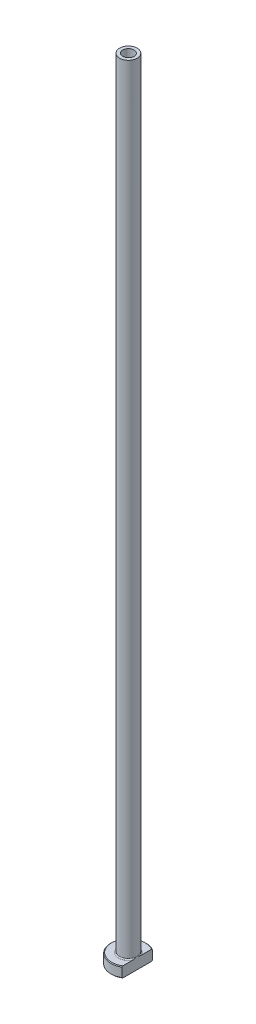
SolidWorks part; units mm, degrees
ref_plane "Front Plane" through (0, 0, 0) normal (0, 0, 1) x (1, 0, 0)
ref_plane "Top Plane" through (0, 0, 0) normal (0, 1, 0) x (1, 0, 0)
ref_plane "Right Plane" through (0, 0, 0) normal (1, 0, 0) x (0, 0, -1)
sketch "Sketch1" plane through (0, 0, 0) normal (0, 0, 1) x (1, 0, 0)
  line L0 (-1.6, 225) -> (-2.5, 225)
  line L1 (-2.5, 225) -> (-2.5, 3)
  line L2 (-2.5, 3) -> (-5, 3)
  line L3 (-5, 3) -> (-5, 0)
  line L4 (4.125, 0) -> (-4.125, 0) construction
  line L5 (-5, 0) -> (-1.85, 0)
  line L6 (-1.6, 180) -> (-1.6, 225)
  line L7 (0, 92.1877) -> (0, -15.5353) construction
  line L8 (0, -5.5) -> (0, 5.5) construction
  line L9 (-1.6, 180) -> (-1.85, 168)
  line L10 (-1.85, 168) -> (-1.85, 0)
  dimension "D1" = 0.25
  dimension "ID" = 3.2
  dimension "OD" = 5
  dimension "L" = 225
  dimension "H" = 10
  dimension "T" = 3
  dimension "N" = 45
  dimension "D2" = 12
  dimension "L-N" = 180
revolve "Revolve1" add sketch "Sketch1" angle 360 about L7
fillet "Fillet1" radius 0.3 1 edges at (0, 3, 2.5)
chamfer "Chamfer1" distance 0.2 angle 45 2 edges at (0, 3, 5) (0, 0, 5)
sketch "Sketch2" plane through (0, 0, 0) normal (0, -1, 0) x (1, 0, 0)
  line L0 (2.5, 4.3301) -> (2.5, -4.3301)
  circle A0 centre (0, 0) radius 5 construction
  arc A1 (2.5, 4.3301) -> (2.5, -4.3301) centre (0, 0) cw
  circle A2 centre (0, 0) radius 2.5 construction
extrude "Cut-Extrude1" cut sketch "Sketch2" against normal through all
chamfer "Chamfer2" distance 0.5 angle 45 1 edges at (0, 0, 1.85)
